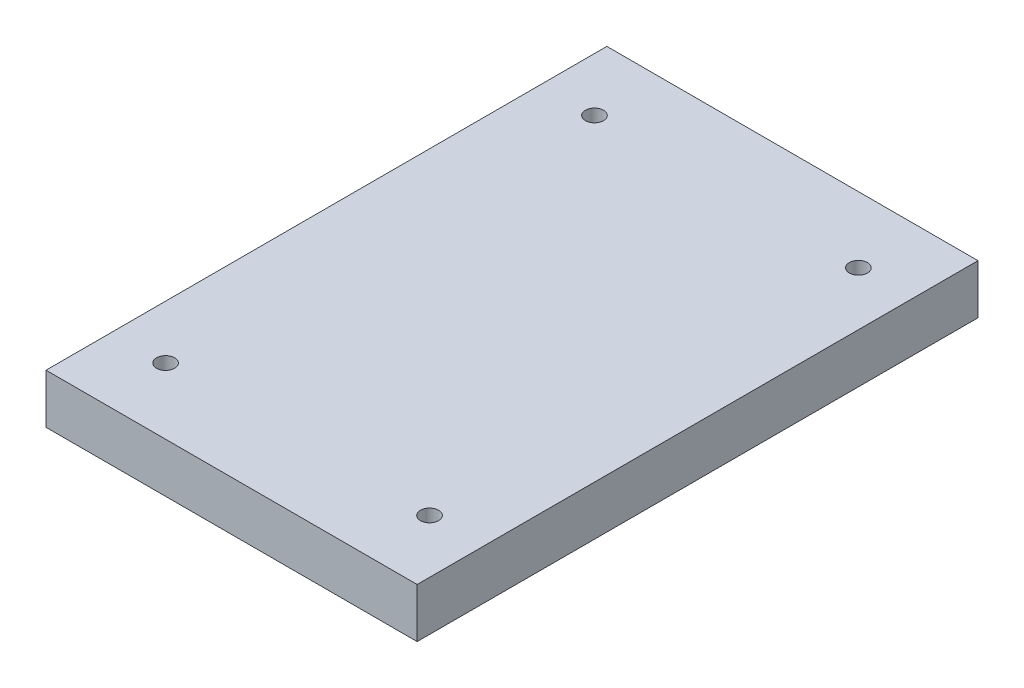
SolidWorks part; units mm, degrees
ref_plane "Plan de face" through (0, 0, 0) normal (0, 0, 1) x (1, 0, 0)
ref_plane "Plan de dessus" through (0, 0, 0) normal (0, 1, 0) x (1, 0, 0)
ref_plane "Plan de droite" through (0, 0, 0) normal (1, 0, 0) x (0, 0, -1)
sketch "Esquisse1" plane through (0, 0, 0) normal (0, 1, 0) x (1, 0, 0)
  line L1 (0, -20.6939) -> (0, 96.124) construction
  line L2 (-2.5, 71) -> (42.5, 71)
  line L3 (-2.5, 71) -> (-2.5, 3)
  line L4 (-2.5, 3) -> (42.5, 3)
  line L5 (-17.0643, 37) -> (104.1811, 37) construction
  line L6 (42.5, 71) -> (42.5, 3)
  line L7 (-2.5, 71) -> (42.5, 3) construction
  line L8 (-2.5, 3) -> (42.5, 71) construction
  line L12 (-17.0643, 63) -> (75.355, 63) construction
  line L13 (4, -13.5506) -> (4, 67.8324) construction
  line L14 (20, -20.6939) -> (20, 48.6985) construction
  circle A6 centre (4, 63) radius 1.1
  circle A7 centre (36, 63) radius 1.1
  circle A8 centre (36, 11) radius 1.1
  circle A9 centre (4, 11) radius 1.1
  point P0 (20, 37)
  dimension "D7" = 26
  dimension "D8" = 4
  dimension "D9" = 20
extrude "Boss.-Extru.1" add sketch "Esquisse1" along normal blind 6
